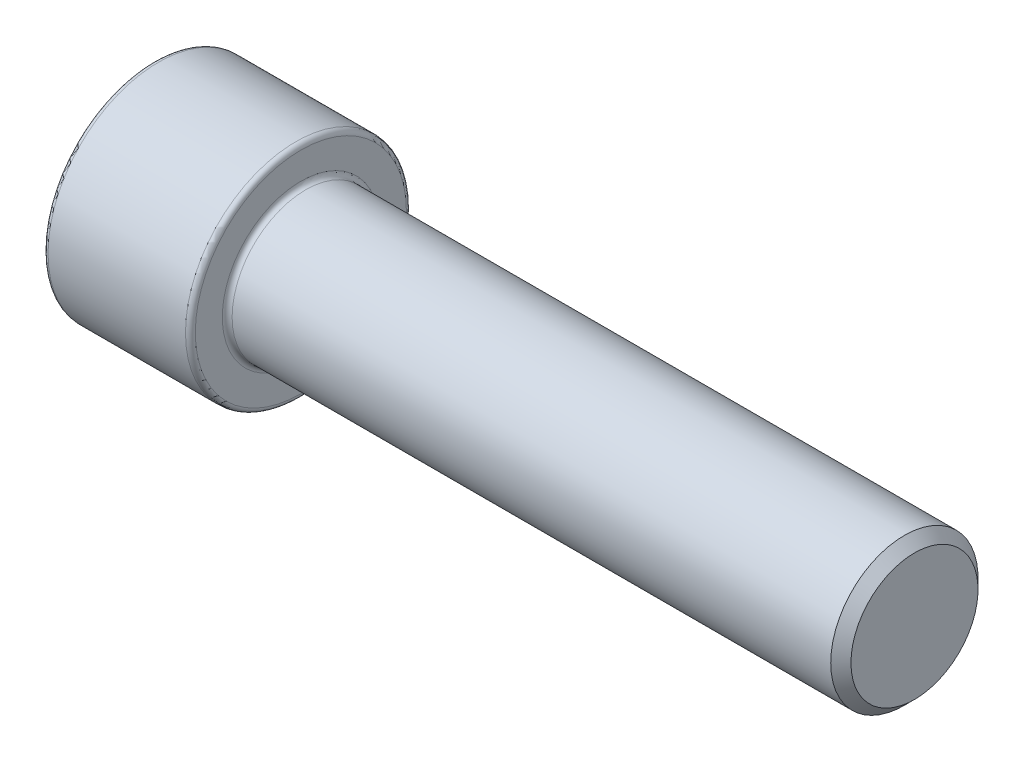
SolidWorks part; units mm, degrees
ref_plane "Front Plane" through (0, 0, 0) normal (0, 0, 1) x (1, 0, 0)
ref_plane "Top Plane" through (0, 0, 0) normal (0, 1, 0) x (1, 0, 0)
ref_plane "Right Plane" through (0, 0, 0) normal (1, 0, 0) x (0, 0, -1)
sketch "BaseHeadSke" plane through (0, 0, 0) normal (1, 0, 0) x (0, 0, -1)
  circle A1 centre (0, 0) radius 18
  dimension "Head_diameter" = 36
extrude "BaseHead" add sketch "BaseHeadSke" along normal blind 24
sketch "BodySke" plane through (0, 0, 0) normal (0, 0, 1) x (1, 0, 0)
  line L0 (0, 0) -> (124, 0)
  line L1 (124, 0) -> (124, 10.352)
  line L2 (124, 10.352) -> (122.352, 12)
  line L3 (122.352, 12) -> (0, 12)
  line L4 (0, 12) -> (0, 0)
  line L6 (0, 0) -> (159.3976, 0) construction
  line L7 (64, -84.3176) -> (64, 77.7215) construction
  line L8 (121, -21.5941) -> (121, 39.2994) construction
  line L10 (24, -18) -> (24, 18) construction
  dimension "Ang" = 45
  dimension "Length" = 100
  dimension "Diameter" = 24
  dimension "Minor_dia" = 20.704
  dimension "Thread_length" = 60
  dimension "Advance" = 3
revolve "BaseBody" add sketch "BodySke" angle 360 about L6
sketch "CutSocketSke" plane through (0, 0, 0) normal (1, 0, 0) x (0, 0, -1)
  line L1 (0, 10.9697) -> (-9.5, 5.4848)
  line L2 (-9.5, 5.4848) -> (-9.5, -5.4848)
  line L3 (-9.5, -5.4848) -> (0, -10.9697)
  line L4 (0, -10.9697) -> (9.5, -5.4848)
  line L5 (9.5, -5.4848) -> (9.5, 5.4848)
  line L6 (9.5, 5.4848) -> (0, 10.9697)
  circle A0 centre (0, 0) radius 9.5 construction
  dimension "Socket_width" = 19
extrude "CutSocket" cut sketch "CutSocketSke" along normal blind 12
sketch "CutHoleSke" plane through (0, 0, 0) normal (0, 0, 1) x (1, 0, 0)
  line L0 (0, 0) -> (149.4323, 0) construction
  line L1 (0, 9.5) -> (13.6, 9.5)
  line L2 (13.6, 9.5) -> (19.0848, 0)
  line L3 (19.0848, 0) -> (0, 0)
  line L4 (0, 0) -> (0, 9.5)
  line L6 (24, -18) -> (24, 18) construction
  dimension "D1" = 60
  dimension "D2" = 19
  dimension "Hole_depth" = 10.4
revolve "CutHole" cut sketch "CutHoleSke" angle 360 about L0
fillet "Fillet" radius 0.8 3 edges at (24, 0, -12) (24, 0, -18) (0, 0, -18)
sketch "ThdSchSke" plane through (0, 0, 0) normal (0, 0, 1) x (1, 0, 0)
  line L0 (120.0485, 13.9029) -> (120.0485, 12)
  line L1 (120.0485, 12) -> (121, 10.352)
  line L2 (121, 10.352) -> (121.9515, 12)
  line L3 (121.9515, 12) -> (121.9515, 13.9029)
  line L4 (121.9515, 13.9029) -> (120.0485, 13.9029)
  line L6 (0, 0) -> (141.9934, 0) construction
  line L7 (124, -10.352) -> (124, 10.352) construction
  dimension "D2" = 20.704
  dimension "D3" = 24
  dimension "Advance" = 3
revolve "ThreadSchematic" [suppressed] cut sketch "ThdSchSke" angle 360 about L6
pattern_linear "ThdSchPat" [suppressed] count 19 spacing 3 along (1, 0, 0)
equation "\"Thread_minor@ThreadCosmetic\" = \"Minor_dia@BodySke\""
equation "\"Thread_length@ThreadCosmetic\" = \"Thread_length@BodySke\""
equation "\"D2@CutHoleSke\" = \"Socket_width@CutSocketSke\""
equation "\"D2@ThdSchSke\" = \"Minor_dia@BodySke\""
equation "\"D3@ThdSchSke\" = \"Diameter@BodySke\""
equation "\"Advance@ThdSchSke\" = \"Advance@BodySke\""
equation "\"D3@ThdSchPat\" = \"Advance@BodySke\""
equation "\"D1@ThdSchPat\" =  int( \"Thread_length@BodySke\"/\"Advance@BodySke\" )-1"
